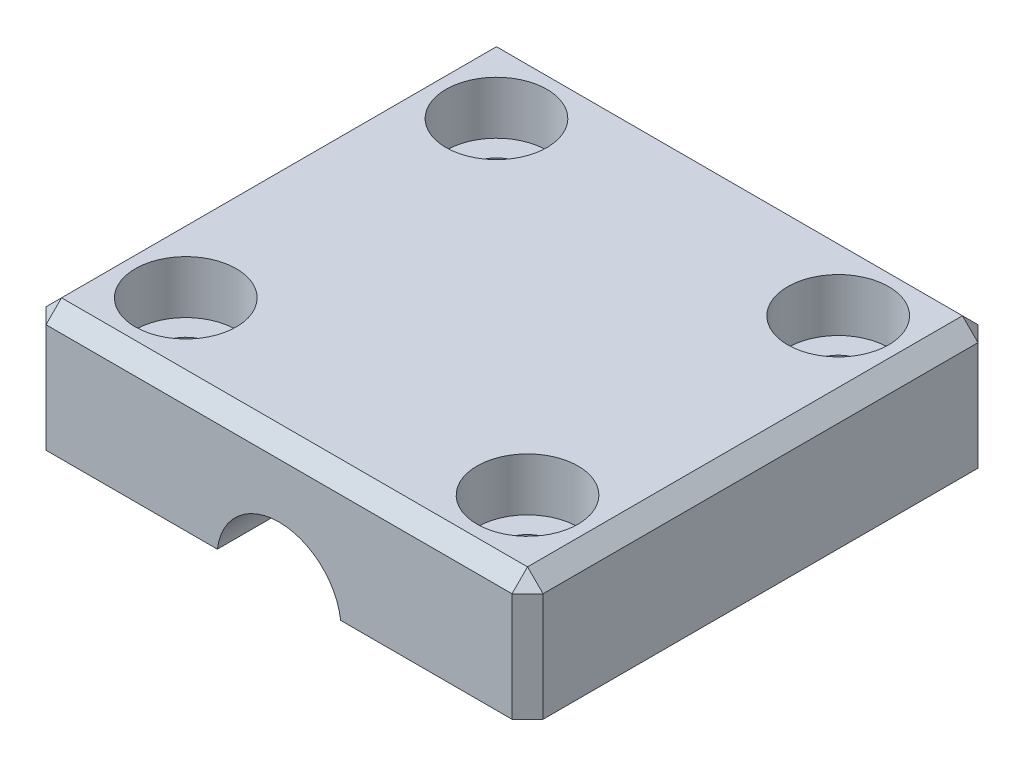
SolidWorks part; units mm, degrees
ref_plane "Ebene vorne" through (0, 0, 0) normal (0, 0, 1) x (1, 0, 0)
ref_plane "Ebene oben" through (0, 0, 0) normal (0, 1, 0) x (1, 0, 0)
ref_plane "Ebene rechts" through (0, 0, 0) normal (1, 0, 0) x (0, 0, -1)
sketch "Skizze1" plane through (0, 0, 0) normal (0, 1, 0) x (1, 0, 0)
  line L1 (-16, -15) -> (16, -15)
  line L2 (-16, -15) -> (-16, 15)
  line L3 (-16, 15) -> (16, 15)
  line L4 (16, -15) -> (16, 15)
  line L5 (-16, -15) -> (16, 15) construction
  line L6 (-16, 15) -> (16, -15) construction
  point P0 (0, 0)
  dimension "D1" = 32
  dimension "D2" = 30
extrude "Aufsatz-Linear austragen1" add sketch "Skizze1" along normal blind 8
hole_wizard "Stirnsenkung für M3 Zylinderschraube mit Innensechskant1" positions "Skizze2" profile "Skizze3" counterbore size "M3" standard "DIN"
sketch "Skizze2" plane through (0, 8, 0) normal (0, 1, 0) x (1, 0, 0)
  line L0 (16, 15) -> (-16, 15) construction
  line L1 (-16, 15) -> (-16, -15) construction
  line L2 (-16, -15) -> (16, -15) construction
  line L3 (16, -15) -> (16, 15) construction
  point P0 (-11, 10)
  point P2 (11, 10)
  point P4 (11, -10)
  point P6 (-11, -10)
  dimension "D1" = 5
  dimension "D2" = 5
  dimension "D3" = 5
  dimension "D4" = 5
sketch "Skizze3" plane through (-11, 8, -10) normal (1, 0, 0) x (0, 0, 1)
  line L0 (0, 0) -> (0, 8)
  line L1 (0, 8) -> (1.7, 8)
  line L3 (1.7, 8) -> (1.7, 3.4)
  line L4 (1.7, 3.4) -> (3.25, 3.4)
  line L5 (3.25, 3.4) -> (3.25, 0)
  line L7 (3.25, 0) -> (0, 0)
  line L11 (0, -6.35) -> (0, 107.95) construction
  dimension "Bohrerdurchmesser" = 3.4
  dimension "Bohrungstiefe" = 8
  dimension "Senkdurchmesser2" = 6.5
  dimension "Senktiefe2" = 3.4
sketch "Skizze4" plane through (0, 0, 15) normal (0, 0, 1) x (1, 0, 0)
  line L0 (-16, 0) -> (16, 0) construction
  circle A0 centre (0, -0.5) radius 4
  dimension "D2" = 8
  dimension "D1" = 0.5
extrude "Schnitt-Linear austragen1" cut sketch "Skizze4" against normal through all
chamfer "Fase1" distance 1 angle 45 8 edges at (-16, 4, -15) (16, 4, -15) (16, 4, 15) (-16, 4, 15) (-16, 8, 0) (0, 8, -15) (16, 8, 0) (0, 8, 15)
